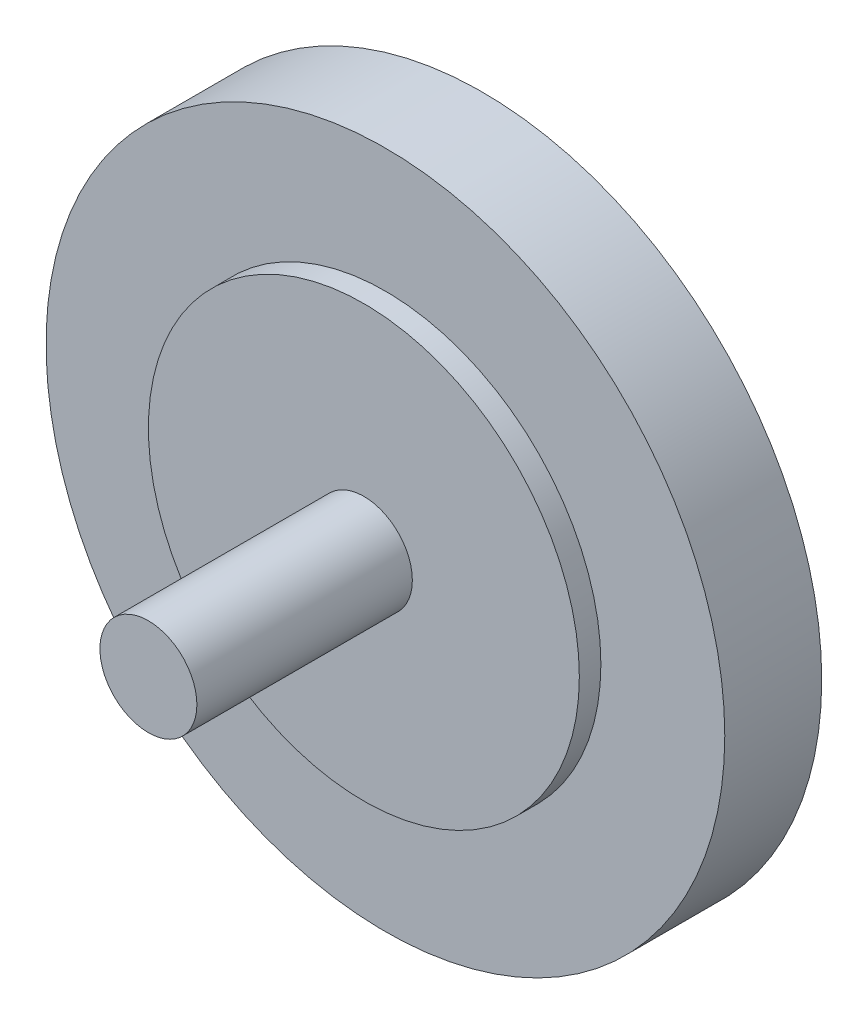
SolidWorks part; units mm, degrees
ref_plane "Plan de face" through (0, 0, 0) normal (0, 0, 1) x (1, 0, 0)
ref_plane "Plan de dessus" through (0, 0, 0) normal (0, 1, 0) x (1, 0, 0)
ref_plane "Plan de droite" through (0, 0, 0) normal (1, 0, 0) x (0, 0, -1)
sketch "Esquisse1" plane through (0, 0, 0) normal (0, 0, 1) x (1, 0, 0)
  circle A0 centre (0, 0) radius 31.5
  dimension "D1" = 63
extrude "Extrusion1" add sketch "Esquisse1" along normal blind 9
sketch "Esquisse2" plane through (0, 0, 9) normal (0, 0, 1) x (1, 0, 0)
  circle A0 centre (0, 0) radius 20
  dimension "D1" = 40
extrude "Extrusion2" add sketch "Esquisse2" along normal blind 2
sketch "Esquisse3" plane through (0, 0, 11) normal (0, 0, 1) x (1, 0, 0)
  circle A0 centre (0, 0) radius 4.5
  dimension "D1" = 9
extrude "Extrusion3" add sketch "Esquisse3" along normal blind 20
sketch "Esquisse4" plane through (0, 0, 0) normal (0, 0, -1) x (-1, 0, 0)
  line L0 (0, 31.5) -> (0, -31.5) construction
  line L1 (-31.5, 0) -> (31.5, 0) construction
  circle A0 centre (0, 0) radius 31.5 construction
